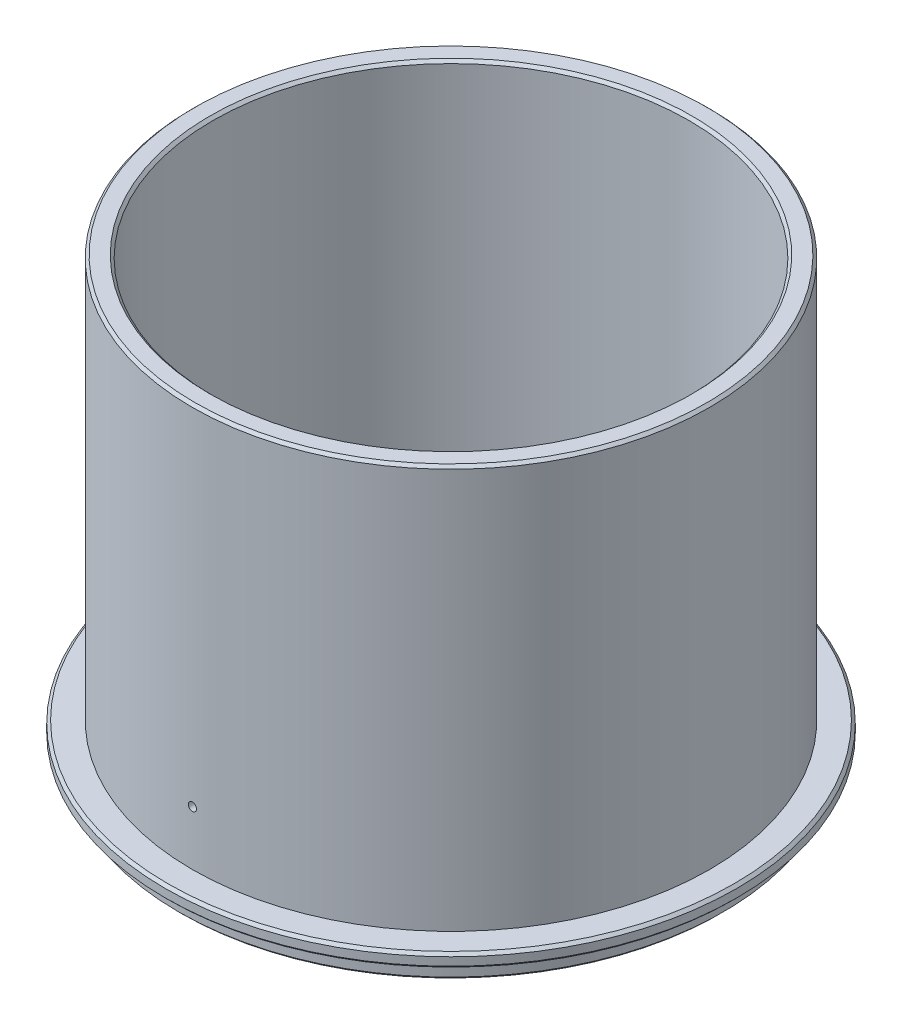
SolidWorks part; units mm, degrees
ref_plane "Front" through (0, 0, 0) normal (0, 0, 1) x (1, 0, 0)
ref_plane "Top" through (0, 0, 0) normal (0, 1, 0) x (1, 0, 0)
ref_plane "Right" through (0, 0, 0) normal (1, 0, 0) x (0, 0, -1)
sketch "Sketch1" plane through (0, 0, 0) normal (1, 0, 0) x (0, 0, -1)
  line L0 (87.5, 0) -> (100, 0)
  line L1 (100, 0) -> (100, 7)
  line L2 (100, 7) -> (105, 7)
  line L3 (105, 7) -> (105, 12)
  line L4 (105, 12) -> (95, 12)
  line L5 (95, 12) -> (95, 160)
  line L6 (95, 160) -> (87.5, 160)
  line L7 (87.5, 160) -> (87.5, 0)
  line L8 (0, 0) -> (0, 160) construction
  dimension "D1" = 200
  dimension "D2" = 7
  dimension "D3" = 12
  dimension "D4" = 210
  dimension "D5" = 190
  dimension "D6" = 175
  dimension "D7" = 160
revolve "Revolve1" add sketch "Sketch1" angle 360 about L8
ref_plane "Plane1" through (0, 32, 0) normal (0, 1, 0) x (-1, 0, 0)
sketch "Sketch3" plane through (0, 32, 0) normal (0, 1, 0) x (1, 0, 0)
  circle A0 centre (0, 0) radius 95 construction
  circle A1 centre (0, 0) radius 95
curve "Helix/Spiral1"
hole_wizard "Ø3.0 (3) Diameter Hole1" positions "3DSketch1" profile "Sketch4" hole size "Ø3.0" standard "ISO"
sketch3d "3DSketch1"
  spline S0 degree 3 poles (0, 32, 95) (-4.6231, 32.6196, 95) (-13.8833, 33.8607, 94.3227) (-27.4665, 35.7209, 91.2964) (-40.4673, 37.5814, 86.3242) (-52.6048, 39.4419, 79.5122) (-63.6213, 41.3023, 71.0056) (-73.2818, 43.1628, 60.9856) (-81.3804, 45.0233, 49.6658) (-87.7446, 46.8837, 37.2874) (-92.2386, 48.7442, 24.1143) (-94.7667, 50.6047, 10.4273) (-95.2751, 52.4651, -3.482) (-93.7528, 54.3256, -17.317) (-90.2323, 56.186, -30.783) (-84.7887, 58.0465, -43.5929) (-77.538, 59.907, -55.4737) (-68.6346, 61.7674, -66.1721) (-58.2685, 63.6279, -75.4602) (-46.6604, 65.4884, -83.14) (-34.0579, 67.3488, -89.0478) (-20.7295, 69.2093, -93.0578) (-6.9593, 71.0698, -95.0843) (6.9593, 72.9302, -95.0843) (20.7295, 74.7907, -93.0578) (34.0579, 76.6512, -89.0478) (46.6604, 78.5116, -83.14) (58.2685, 80.3721, -75.4602) (68.6346, 82.2326, -66.1721) (77.538, 84.093, -55.4737) (84.7887, 85.9535, -43.5929) (90.2323, 87.814, -30.783) (93.7528, 89.6744, -17.317) (95.2751, 91.5349, -3.482) (94.7667, 93.3953, 10.4273) (92.2386, 95.2558, 24.1143) (87.7446, 97.1163, 37.2874) (81.3804, 98.9767, 49.6658) (73.2818, 100.8372, 60.9856) (63.6213, 102.6977, 71.0056) (52.6048, 104.5581, 79.5122) (40.4673, 106.4186, 86.3242) (27.4665, 108.2791, 91.2964) (13.8833, 110.1393, 94.3227) (4.6231, 111.3804, 95) (0, 112, 95) knots 0 0 0 0 0.023256 0.046512 0.069767 0.093023 0.116279 0.139535 0.162791 0.186047 0.209302 0.232558 0.255814 0.27907 0.302326 0.325581 0.348837 0.372093 0.395349 0.418605 0.44186 0.465116 0.488372 0.511628 0.534884 0.55814 0.581395 0.604651 0.627907 0.651163 0.674419 0.697674 0.72093 0.744186 0.767442 0.790698 0.813953 0.837209 0.860465 0.883721 0.906977 0.930233 0.953488 0.976744 1 1 1 1 construction
  point P0 (0, 32, 95)
sketch "Sketch4" plane through (0, 32, 95) normal (1, 0, 0) x (0, -1, 0)
  line L0 (0, 0) -> (0, 182.501)
  line L1 (0, 182.501) -> (1.5, 182.501)
  line L2 (1.5, 182.501) -> (1.5, 0)
  line L5 (1.5, 0) -> (0, 0)
  line L11 (0, -6.35) -> (0, 107.95) construction
  dimension "Thru Hole Dia." = 3
  dimension "Thru Hole Depth" = 182.501
pattern_curve "CrvPattern1" [suppressed] parameters "D1"=50, "D3"=1, "D2"=1, "D4"=1
pattern_circular "CirPattern1" [suppressed] count 2 over 360
chamfer "Chamfer1" distance 1 angle 45 2 edges at (0, 160, -95) (0, 160, -87.5)
chamfer "Chamfer2" distance 1 angle 45 3 edges at (0, 7, -105) (0, 12, -105) (0, 0, -100)
